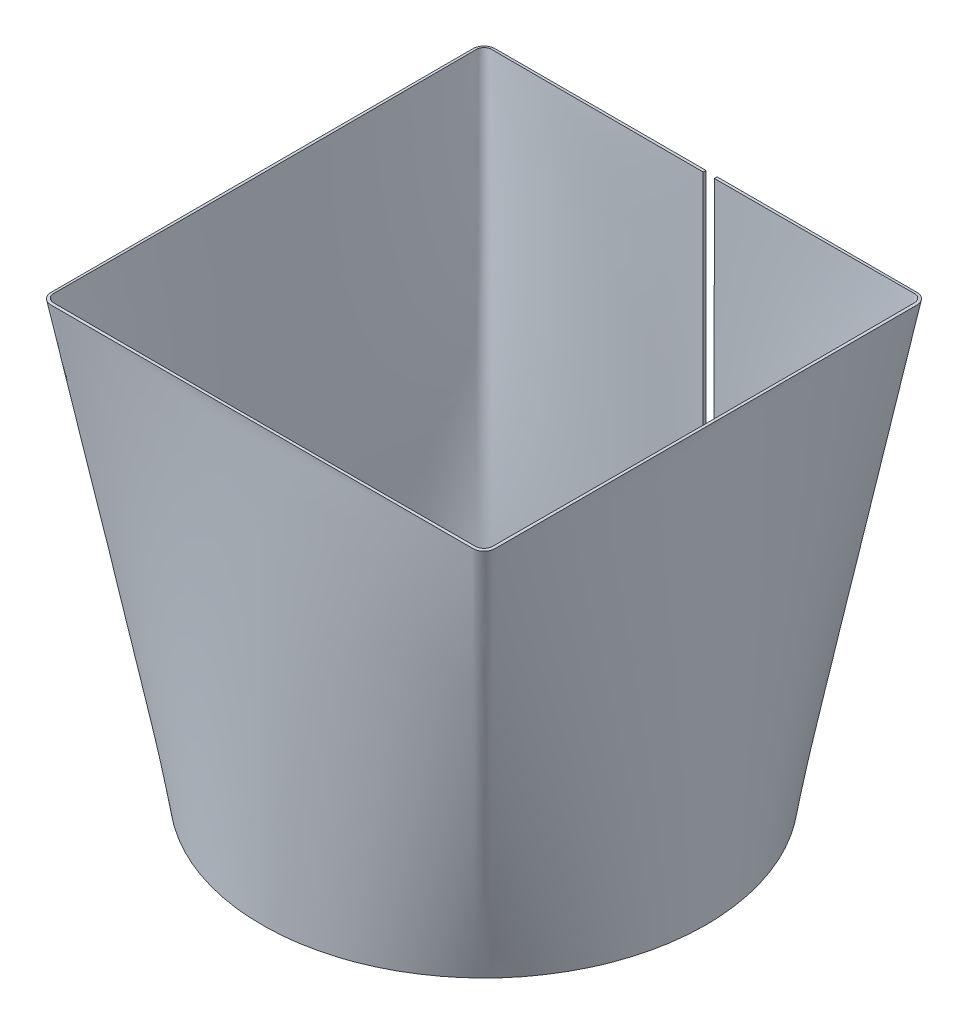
SolidWorks part; units mm, degrees
ref_plane "Vorderansicht" through (0, 0, 0) normal (0, 0, 1) x (1, 0, 0)
ref_plane "Draufsicht" through (0, 0, 0) normal (0, 1, 0) x (1, 0, 0)
ref_plane "Seitenansicht" through (0, 0, 0) normal (1, 0, 0) x (0, 0, -1)
ref_plane "Ebene1" through (0, 77.724, 0) normal (0, 1, 0) x (-1, 0, 0)
sketch "Skizze1" plane through (0, 0, 0) normal (0, 1, 0) x (1, 0, 0)
  arc A0 (0, 40) -> (1.9994, 39.95) centre (0, 0) ccw
  dimension "D1" = 40
  dimension "D2" = 2
sketch "Skizze2" plane through (0, 77.724, 0) normal (0, 1, 0) x (-1, 0, 0)
  line L0 (0, -40) -> (38, -40)
  line L1 (40, -38) -> (40, 38)
  line L2 (38, 40) -> (-38, 40)
  line L3 (-40, 38) -> (-40, -38)
  line L4 (-38, -40) -> (-2, -40)
  arc A0 (0, -40) -> (-1.9994, -39.95) centre (0, 0) ccw construction
  arc A1 (38, -40) -> (40, -38) centre (38, -38) ccw
  arc A2 (-40, -38) -> (-38, -40) centre (-38, -38) ccw
  arc A3 (40, 38) -> (38, 40) centre (38, 38) ccw
  arc A4 (-38, 40) -> (-40, 38) centre (-38, 38) ccw
  dimension "D2" = 2
  dimension "D1" = 2
sheet metal parameters "Blech1" thickness 0.5 parameters "D1"=1, "Dicke"=0.5
lofted bend "Ausgeformte Biegungen1" parameters "D1"=0, "D12"=0.5
other "Freiform-Biegung1" parameters "D1"=1000, "D4"=57.296, "D5"=1
flat pattern "Abwicklung1"
sketch "Biegung-Linien1" plane through (0, 0, 0) normal (0, 1, 0) x (-1, 0, 0)
other "Abwickeln-<Freiform-Biegung1>1"
